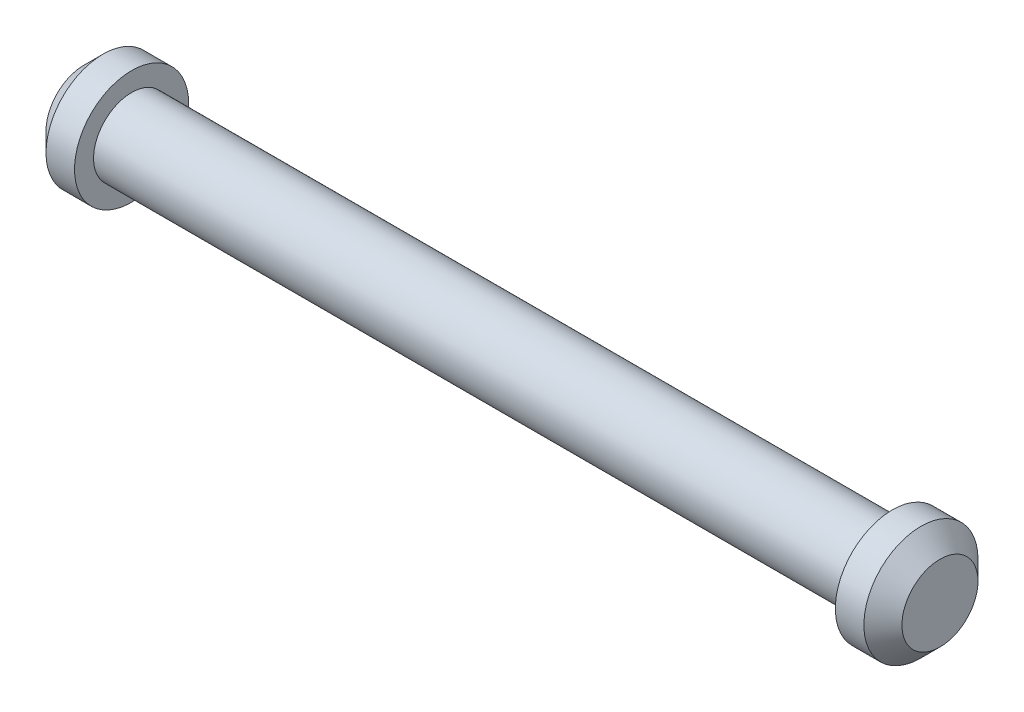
SolidWorks part; units mm, degrees
ref_plane "Front Plane" through (0, 0, 0) normal (0, 0, 1) x (1, 0, 0)
ref_plane "Top Plane" through (0, 0, 0) normal (0, 1, 0) x (1, 0, 0)
ref_plane "Right Plane" through (0, 0, 0) normal (1, 0, 0) x (0, 0, -1)
sketch "Sketch1" plane through (0, 0, 0) normal (1, 0, 0) x (0, 0, -1)
  circle A0 centre (0, 0) radius 4
  dimension "D1" = 8
extrude "Boss-Extrude1" add sketch "Sketch1" along normal mid plane 80
sketch "Sketch2" plane through (40, 0, 0) normal (1, 0, 0) x (0, 0, -1)
  circle A0 centre (0, 0) radius 6
  dimension "D1" = 12
extrude "Boss-Extrude2" add sketch "Sketch2" along normal blind 5
chamfer "Chamfer1" distance 2 angle 45 1 edges at (45, 0, -6)
mirror "Mirror1" about plane through (0, 0, 0) normal (1, 0, 0) of "Boss-Extrude2", "Chamfer1"
